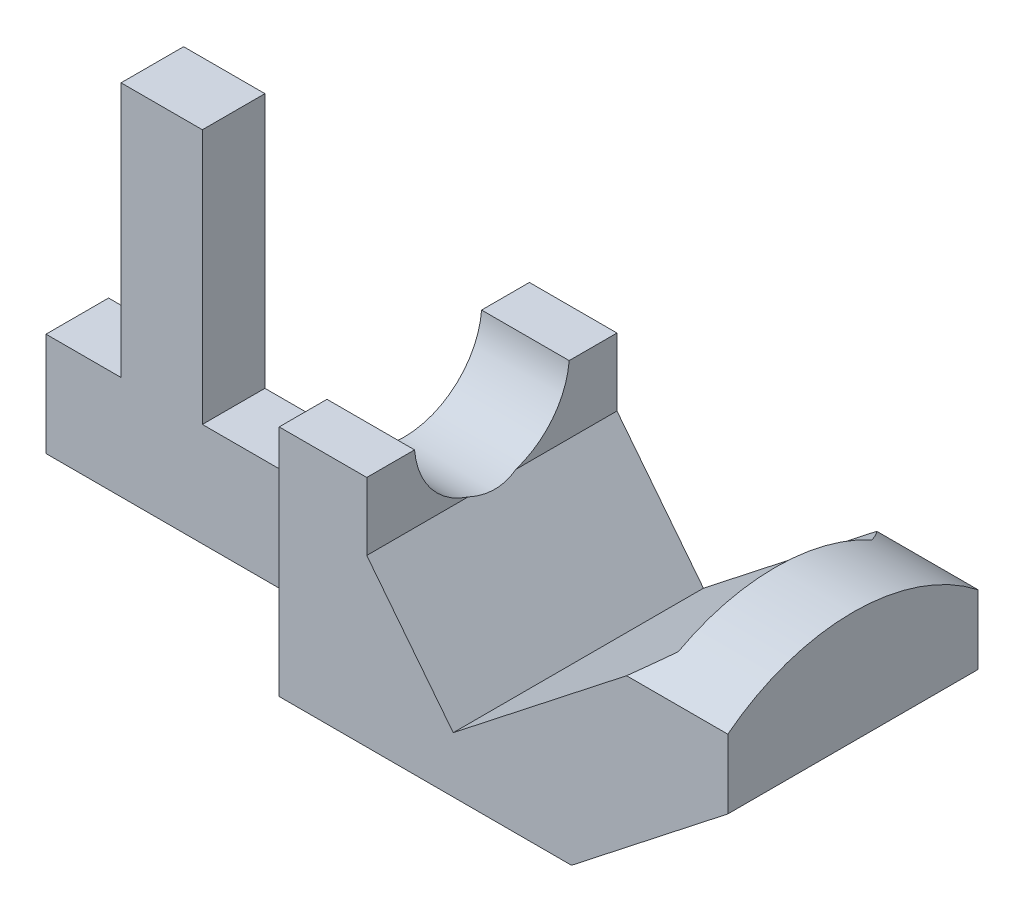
SolidWorks part; units mm, degrees
ref_plane "Front Plane" through (0, 0, 0) normal (0, 0, 1) x (1, 0, 0)
ref_plane "Top Plane" through (0, 0, 0) normal (0, 1, 0) x (1, 0, 0)
ref_plane "Right Plane" through (0, 0, 0) normal (1, 0, 0) x (0, 0, -1)
sketch "Sketch1" plane through (0, 0, 0) normal (0, 0, 1) x (1, 0, 0)
  line L1 (0, 0) -> (-101.6, 0)
  line L2 (0, 0) -> (0, 101.6)
  line L3 (0, 101.6) -> (-101.6, 101.6)
  line L4 (-101.6, 0) -> (-101.6, 101.6)
  dimension "D1" = 101.6
  dimension "D2" = 101.6
extrude "stock" add sketch "Sketch1" along normal blind 3.175
sketch "Sketch2" plane through (0, 0, 3.175) normal (0, 0, 1) x (1, 0, 0)
  line L0 (-18.9351, 46.7221) -> (-18.9351, 37.8321)
  line L1 (-97.6751, 25.3861) -> (-34.8007, 25.3861)
  line L2 (-97.6751, 25.3861) -> (-97.6751, 35.8852)
  line L3 (-18.9351, 46.7221) -> (-26.8243, 46.7221)
  line L4 (-26.8243, 46.7221) -> (-46.8089, 31.0448)
  line L5 (-46.8089, 31.0448) -> (-48.7686, 33.5429)
  line L6 (-48.7686, 33.5429) -> (-55.5873, 42.2352)
  line L7 (-90.0551, 61.7932) -> (-81.8001, 61.7932)
  line L8 (-81.8001, 61.7932) -> (-81.8001, 35.8852)
  line L9 (-81.8001, 35.8852) -> (-77.9901, 35.8852)
  line L10 (-77.9901, 35.8852) -> (-77.9901, 42.2352)
  line L11 (-77.9901, 42.2352) -> (-55.5873, 42.2352) construction
  line L12 (-77.9901, 35.8852) -> (-18.9351, 35.8852) construction
  line L13 (-48.7686, 33.5429) -> (-28.784, 49.2202) construction
  line L14 (-26.8243, 46.7221) -> (-28.784, 49.2202) construction
  line L15 (-97.6751, 35.8852) -> (-90.0551, 35.8852)
  line L16 (-90.0551, 35.8852) -> (-90.0551, 61.7932)
  line L17 (-46.8089, 31.0448) -> (-17.4916, 31.0448) construction
  line L18 (-55.5873, 42.2352) -> (-55.5873, 53.2269)
  line L19 (-55.5873, 53.2269) -> (-77.9901, 53.2269)
  line L20 (-77.9901, 53.2269) -> (-77.9901, 42.2352)
  line L21 (-18.9351, 37.8321) -> (-34.8007, 25.3861)
  dimension "D1" = 25.4
  dimension "D2" = 3.175
  dimension "D3" = 6.985
  dimension "D4" = 6.35
  dimension "D5" = 25.908
  dimension "D6" = 3.81
  dimension "D7" = 8.255
  dimension "D8" = 7.62
  dimension "D9" = 26.2128
  dimension "D10" = 21.336
  dimension "D11" = 38.113
  dimension "D12" = 78.74
  dimension "D13" = 8.89
extrude "main shape" cut sketch "Sketch2" against normal blind 6.35 flip side to cut
sketch "Sketch3" plane through (0, 0, 3.175) normal (0, 0, 1) x (1, 0, 0)
  line L0 (-64.4773, 43.5074) -> (-64.4773, 25.3861)
  line L1 (-97.6751, 25.3861) -> (-34.8007, 25.3861) construction
  line L3 (-64.4773, 25.3861) -> (-34.8007, 25.3861)
  line L4 (-34.8007, 25.3861) -> (-18.9351, 37.8321)
  line L5 (-18.9351, 37.8321) -> (-18.9351, 46.7221)
  line L6 (-18.9351, 46.7221) -> (-26.8243, 46.7221)
  line L7 (-46.8089, 31.0448) -> (-55.5873, 42.2352)
  line L8 (-64.4773, 43.5074) -> (-64.4773, 53.2269)
  line L9 (-55.5873, 53.2269) -> (-77.9901, 53.2269) construction
  line L10 (-64.4773, 53.2269) -> (-55.5873, 53.2269)
  line L11 (-55.5873, 53.2269) -> (-55.5873, 42.2352)
  line L12 (-26.8243, 46.7221) -> (-46.8089, 31.0448)
  dimension "D1" = 8.89
extrude "Extrude2" add sketch "Sketch3" along normal blind 9.525
fillet "Fillet2" radius 3.81
mirror "Mirror1" about plane through (0, 0, 0) normal (0, 0, 1) of "Fillet2", "main shape", "stock", "Extrude2"
sketch "Sketch4" plane through (-55.5873, 0, 0) normal (1, 0, 0) x (0, 0, -1)
  line L2 (0, 46.7221) -> (0, 49.7266) construction
  line L3 (12.7, 46.7221) -> (-12.7, 46.7221) construction
  circle A0 centre (0, 49.7266) radius 7.874
  dimension "D1" = 15.748
  dimension "D2" = 3.0045
extrude "camera shaft" cut sketch "Sketch4" against normal up to surface and the other way up to next
sketch "Sketch5" plane through (-64.4773, 0, 0) normal (1, 0, 0) x (0, 0, -1)
  line L1 (-3.175, 53.2269) -> (3.175, 53.2269)
  line L2 (-3.175, 53.2269) -> (-3.175, 35.8852)
  line L3 (-3.175, 35.8852) -> (3.175, 35.8852)
  line L4 (3.175, 53.2269) -> (3.175, 35.8852)
extrude "Cut-Extrude2" cut sketch "Sketch5" against normal up to next
sketch "Sketch6" plane through (0, 0, 12.7) normal (0, 0, 1) x (1, 0, 0)
  line L0 (-55.5873, 42.2352) -> (-55.5873, 53.2269) construction
  line L1 (-64.4773, 53.2269) -> (-55.5873, 53.2269)
  line L2 (-64.4773, 53.2269) -> (-64.4773, 49.0932)
  line L3 (-64.4773, 49.0932) -> (-55.5873, 49.0932)
  line L4 (-55.5873, 53.2269) -> (-55.5873, 49.0932)
  dimension "D1" = 6.858
extrude "Cut-Extrude3" cut sketch "Sketch6" against normal through all
sketch "Sketch7" plane through (0, 46.7221, 0) normal (0, 1, 0) x (-1, 0, 0)
  line L1 (18.9351, -12.7) -> (26.8243, -12.7)
  line L2 (18.9351, -12.7) -> (18.9351, 12.7)
  line L3 (18.9351, 12.7) -> (26.8243, 12.7)
  line L4 (26.8243, -12.7) -> (26.8243, 12.7)
extrude "Extrude3" add sketch "Sketch7" along normal blind 8.636
sketch "Sketch8" plane through (-18.9351, 0, 0) normal (1, 0, 0) x (0, 0, -1)
  line L0 (-12.7, 25.3861) -> (-12.7, 37.8321) construction
  line L1 (12.7, 37.8321) -> (12.7, 55.3581) construction
  line L2 (0, 42.2352) -> (0, 49.2202) construction
  line L3 (12.7, 44.8497) -> (12.7, 55.3581)
  line L4 (12.7, 55.3581) -> (-12.7, 55.3581)
  line L5 (-12.7, 55.3581) -> (-12.7, 44.8497)
  line L6 (-12.7, 42.2352) -> (12.7, 42.2352) construction
  arc A0 (-12.7, 44.8497) -> (12.7, 44.8497) centre (0, 28.5827) cw
  dimension "D1" = 20.6375
  dimension "D2" = 6.985
extrude "Cut-Extrude4" cut sketch "Sketch8" against normal up to next
sketch "Sketch9" plane through (0, 61.7932, 0) normal (0, 1, 0) x (-1, 0, 0)
  line L0 (90.0551, 0) -> (81.8001, 0) construction
  line L1 (90.0551, -3.175) -> (90.0551, 3.175) construction
  line L2 (81.8001, -3.175) -> (81.8001, 3.175) construction
hole_wizard "#4-40 Tapped Hole1" positions "3DSketch1" profile "Sketch11" tap size "#4-40" standard "Ansi Inch"
sketch3d "3DSketch1"
  line L1 (-90.0551, 61.7932, 0) -> (-81.8001, 61.7932, 0) construction
  point P7 (-85.9276, 61.7932, 0)
sketch "Sketch11" plane through (-85.9276, 61.7932, 0) normal (1, 0, 0) x (0, 0, 1)
  line L0 (0, 0) -> (0, 19.2212)
  line L1 (0, 19.2212) -> (1.1303, 18.542)
  line L2 (1.1303, 18.542) -> (1.1303, 0)
  line L5 (1.1303, 0) -> (0, 0)
  line L10 (0, 19.2212) -> (-1.1303, 18.542) construction
  line L11 (0, -6.35) -> (0, 107.95) construction
  dimension "Tap Drill Dia." = 2.2606
  dimension "Tap Drill Depth" = 18.542
  dimension "Drill Angle" = 118
sketch "Sketch12" plane through (0, 0, -12.7) normal (0, 0, -1) x (-1, 0, 0)
  line L0 (27.8296, 47.5151) -> (27.8296, 26.5329)
  line L1 (62.616, 26.5329) -> (17.0738, 26.5329) construction
  line L2 (27.8296, 26.5329) -> (53.726, 26.5329)
  line L3 (53.726, 26.5329) -> (53.726, 39.4313)
  line L4 (53.726, 39.4313) -> (51.8253, 39.4313)
  line L5 (50.6358, 36.8804) -> (53.726, 43.5074) construction
  line L6 (51.8253, 39.4313) -> (50.6358, 36.8804)
  line L7 (50.6358, 36.8804) -> (27.8296, 47.5151)
  dimension "D1" = 25
  dimension "D2" = 20.9822
  dimension "D3" = 25.8964
sketch "Sketch15" plane through (0, 0, -3.175) normal (0, 0, -1) x (-1, 0, 0)
  line L0 (53.726, 26.5329) -> (95.8138, 26.5329)
  line L1 (95.8138, 26.5329) -> (95.8138, 37.1574)
  line L2 (95.8138, 37.1574) -> (88.1938, 37.1574)
  line L3 (88.1938, 37.1574) -> (88.1938, 63.0654)
  line L4 (88.1938, 63.0654) -> (79.9388, 63.0654)
  line L5 (79.9388, 63.0654) -> (79.9388, 37.1574)
  line L6 (79.9388, 37.1574) -> (53.726, 37.1574)
  line L7 (53.726, 26.5329) -> (53.726, 39.4313) construction
  line L8 (53.726, 37.1574) -> (53.726, 26.5329)
